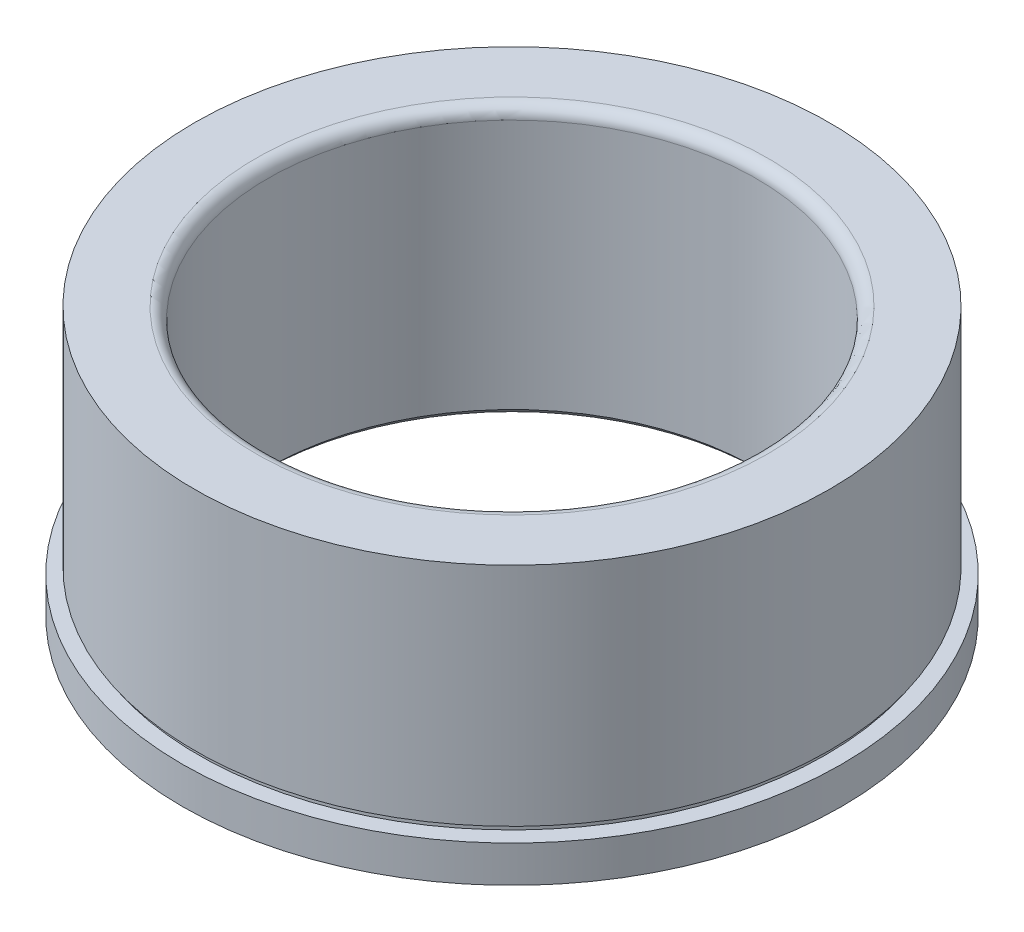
SolidWorks part; units mm, degrees
ref_plane "Front Plane" through (0, 0, 0) normal (0, 0, 1) x (1, 0, 0)
ref_plane "Top Plane" through (0, 0, 0) normal (0, 1, 0) x (1, 0, 0)
ref_plane "Right Plane" through (0, 0, 0) normal (1, 0, 0) x (0, 0, -1)
sketch "Sketch1" plane through (0, 0, 0) normal (0, 0, 1) x (1, 0, 0)
  line L0 (-954.952, 354.8153) -> (45914.4077, -17059.6364) construction
  line L1 (0, -1000) -> (0, 49000) construction
  line L2 (-31.7563, 50.8507) -> (-31.7563, 16.7417)
  line L3 (-32.5724, 15.9257) -> (-42.8625, 15.9257)
  line L4 (-42.8625, 15.9257) -> (-42.8625, 20.6882)
  line L5 (-42.8625, 20.6882) -> (-40.7733, 20.6882)
  line L6 (-41.2813, 50.8507) -> (-41.2813, 21.4502)
  line L7 (-41.2813, 50.8507) -> (-31.7563, 50.8507)
  line L8 (-32.5724, 15.9257) -> (-31.7563, 16.7417)
  line L10 (-41.2813, 21.4502) -> (-40.7733, 21.4502)
  line L11 (-40.7733, 21.4502) -> (-40.7733, 20.6882)
  dimension "D1" = 0.508
  dimension "OD" = 82.5627
  dimension "ID" = 63.5127
  dimension "FLANGETHICKNESS" = 4.7625
  dimension "FLANGEDIA" = 85.725
  dimension "D2" = 45
  dimension "D3" = 0.762
  dimension "OVERALL LENGTH" = 34.925
revolve "Revolve1" add sketch "Sketch1" angle 360 about L1
fillet "Fillet1" radius 1.524 1 edges at (31.7563, 50.8507, 0)
